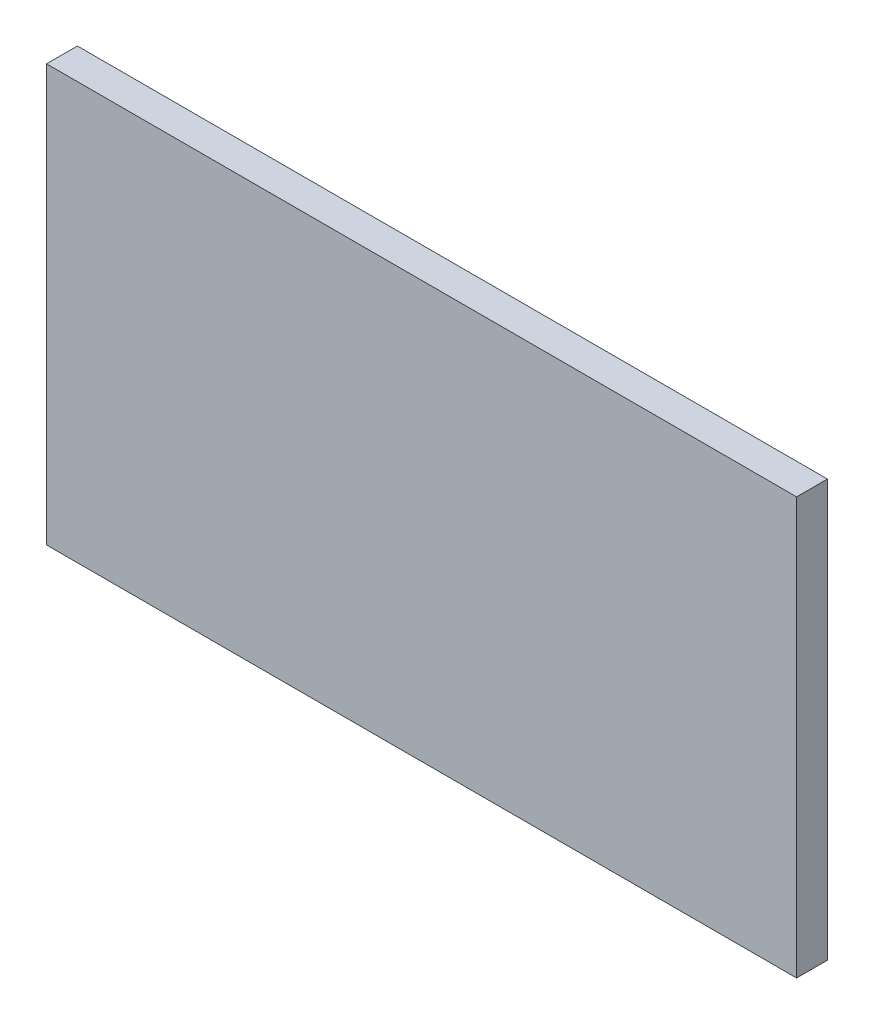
SolidWorks part; units mm, degrees
ref_plane "Спереди" through (0, 0, 0) normal (0, 0, 1) x (1, 0, 0)
ref_plane "Сверху" through (0, 0, 0) normal (0, 1, 0) x (1, 0, 0)
ref_plane "Справа" through (0, 0, 0) normal (1, 0, 0) x (0, 0, -1)
sketch "Эскиз1" plane through (0, 0, 0) normal (0, 0, 1) x (1, 0, 0)
  line L4 (0, -1514.1368) -> (0, -2014.1368)
  line L5 (-900, -1514.1368) -> (-900, -2014.1368)
  line L24 (0, -2014.1368) -> (-900, -2014.1368)
  line L28 (-900, -1514.1368) -> (0, -1514.1368)
  dimension "D1" = 500
extrude "Вытянуть1" add sketch "Эскиз1" along normal blind 37
